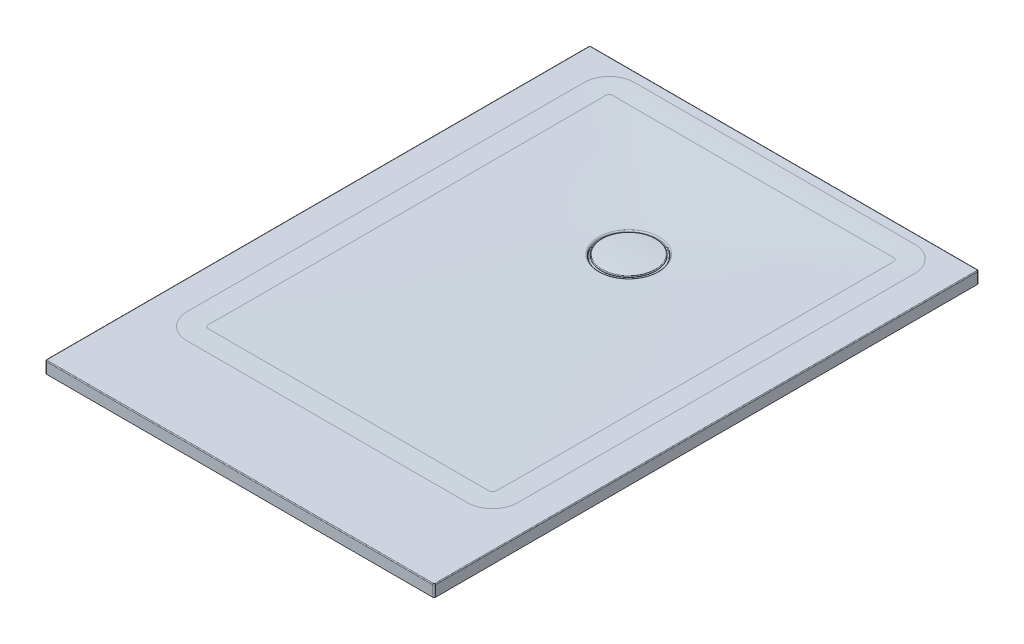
SolidWorks part; units mm, degrees
ref_plane "Płaszczyzna przednia" through (0, 0, 0) normal (0, 0, 1) x (1, 0, 0)
ref_plane "Płaszczyzna górna" through (0, 0, 0) normal (0, 1, 0) x (1, 0, 0)
ref_plane "Płaszczyzna prawa" through (0, 0, 0) normal (1, 0, 0) x (0, 0, -1)
sketch "Szkic2" plane through (0, 0, 0) normal (0, 1, 0) x (1, 0, 0)
  line L0 (0, 700) -> (0, 300) construction
  line L1 (-500, -700) -> (500, -700)
  line L2 (-500, -700) -> (-500, 700)
  line L3 (-500, 700) -> (500, 700)
  line L4 (500, -700) -> (500, 700)
  line L5 (-500, -700) -> (500, 700) construction
  line L6 (-500, 700) -> (500, -700) construction
  line L7 (-410, 660) -> (410, 660)
  line L8 (-410, 660) -> (-410, -460)
  line L9 (-410, -460) -> (410, -460)
  line L10 (410, 660) -> (410, -460)
  line L11 (-450, 700) -> (-450, -500) construction
  line L12 (-450, -500) -> (450, -500) construction
  line L13 (450, -500) -> (450, 700) construction
  circle A0 centre (0, 300) radius 75
  point P0 (0, 0)
  point P11 (0, 660)
  point P16 (0, -500)
  dimension "D9" = 150
  dimension "D1" = 1000
  dimension "D2" = 1400
  dimension "D3" = 40
  dimension "D4" = 90
  dimension "D5" = 40
  dimension "D6" = 50
  dimension "D7" = 1200
  dimension "D8" = 400
  dimension "D10" = 900
sketch "Szkic3" plane through (0, 0, 0) normal (0, 1, 0) x (1, 0, 0)
  line L0 (-500, -700) -> (-500, 700) construction
  line L1 (-500, -700) -> (500, -700) construction
  line L2 (500, -700) -> (500, 700) construction
  line L3 (-500, 700) -> (500, 700) construction
  line L4 (-410, 660) -> (-410, -460) construction
  line L5 (-410, 660) -> (410, 660) construction
  line L6 (410, 660) -> (410, -460) construction
  line L7 (-410, -460) -> (410, -460) construction
  line L8 (-500, -700) -> (-500, 700)
  line L9 (-500, -700) -> (500, -700)
  line L10 (500, -700) -> (500, 700)
  line L11 (-500, 700) -> (500, 700)
  line L12 (-410, 610) -> (-410, -410)
  line L13 (-360, 660) -> (360, 660)
  line L14 (410, 610) -> (410, -410)
  line L15 (-360, -460) -> (360, -460)
  arc A0 (410, 610) -> (360, 660) centre (360, 610) ccw
  arc A1 (-360, 660) -> (-410, 610) centre (-360, 610) ccw
  arc A2 (360, -460) -> (410, -410) centre (360, -410) ccw
  arc A3 (-360, -460) -> (-410, -410) centre (-360, -410) cw
  dimension "D1" = 50
surface "Powierzchnia-Płaszczyzna1" sketch "Szkic3"
sketch "Szkic4" plane through (0, 0, 0) normal (0, 1, 0) x (1, 0, 0)
  line L0 (-410, 660) -> (-410, -460) construction
  line L1 (-410, -460) -> (410, -460) construction
  line L2 (410, 660) -> (410, -460) construction
  line L3 (-410, 660) -> (410, 660) construction
  line L4 (-410, 660) -> (-410, -460)
  line L5 (-410, -460) -> (410, -460)
  line L6 (410, 660) -> (410, -460)
  line L7 (-410, 660) -> (410, 660)
ref_plane "korek" through (0, -15, 0) normal (0, 1, 0) x (-1, 0, 0)
sketch "Szkic5" plane through (0, -15, 0) normal (0, 1, 0) x (-1, 0, 0)
  circle A0 centre (0, -300) radius 75 construction
  circle A1 centre (0, -300) radius 75
surface "Powierzchnia-Wyciągnięcie po profilach2"
surface "Powierzchnia-Połącz1"
sketch "Szkic7" plane through (0, 0, 0) normal (0, 1, 0) x (1, 0, 0)
  line L27 (360, 620) -> (-360, 620)
  line L28 (-370, 610) -> (-370, -410)
  line L29 (-360, -420) -> (360, -420)
  line L30 (370, -410) -> (370, 610)
  line L31 (360, 620) -> (-360, 620)
  line L32 (-370, 610) -> (-370, -410)
  line L33 (-360, -420) -> (360, -420)
  line L34 (370, -410) -> (370, 610)
  line L35 (360, 675) -> (-360, 675)
  line L36 (-425, 610) -> (-425, -410)
  line L37 (-360, -475) -> (360, -475)
  line L38 (425, -410) -> (425, 610)
  line L39 (360, 675) -> (-360, 675)
  line L40 (-425, 610) -> (-425, -410)
  line L41 (-360, -475) -> (360, -475)
  line L42 (425, -410) -> (425, 610)
  arc A0 (370, -410) -> (360, -420) centre (360, -410) cw
  arc A1 (-370, -410) -> (-360, -420) centre (-360, -410) ccw
  arc A2 (370, 610) -> (360, 620) centre (360, 610) ccw
  arc A3 (-370, 610) -> (-360, 620) centre (-360, 610) cw
  spline S23 degree 3 poles (-591.5315, 335.3132) (181.3742, 504.6125) (377.0466, 575.5657) (369.7449, 612.2673) (369.6662, 612.584) (369.476, 613.2118) (369.3643, 613.5239) (368.9883, 614.4318) (368.6815, 615.006) (368.1377, 615.8209) (367.9418, 616.0856) (367.524, 616.5953) (367.3041, 616.8378) (366.6129, 617.5297) (366.1098, 617.9436) (365.2909, 618.492) (365.007, 618.6624) (364.4301, 618.9712) (364.1356, 619.1106) (363.5344, 619.3603) (363.2278, 619.4704) (362.6025, 619.6612) (362.282, 619.7412) (361.6363, 619.8714) (361.3114, 619.9185) (360.8216, 619.9669) (360.658, 619.9804) (348.1323, 620.6176) (332.3408, 590.3401) (433.8681, 1617.1995) knots -6.99685 -6.99685 -6.99685 -6.99685 0.125 0.125 0.1875 0.1875 0.25 0.25 0.375 0.375 0.4375 0.4375 0.5 0.5 0.625 0.625 0.6875 0.6875 0.75 0.75 0.8125 0.8125 0.875 0.875 0.9375 0.9375 0.96875 0.96875 3.322401 3.322401 3.322401 3.322401 only from (370, 610) to (360, 620)
  spline S24 degree 3 poles (-491.8511, 1611.2627) (-330.4534, 590.295) (-348.1092, 620.6178) (-360.657, 619.9805) (-360.8198, 619.967) (-361.3068, 619.919) (-361.629, 619.8725) (-362.2675, 619.7445) (-362.5843, 619.6661) (-363.2122, 619.4758) (-363.5243, 619.3642) (-364.4322, 618.9881) (-365.0063, 618.6813) (-366.0929, 617.9563) (-366.6075, 617.5344) (-367.5298, 616.6126) (-367.9438, 616.1096) (-368.4922, 615.2907) (-368.6624, 615.0068) (-368.9713, 614.43) (-369.1107, 614.1354) (-369.3603, 613.5343) (-369.4705, 613.2277) (-369.6612, 612.6023) (-369.7416, 612.282) (-379.3828, 564.1048) (-33.6844, 476.7199) (597.6089, 357.5576) knots -2.333455 -2.333455 -2.333455 -2.333455 0.03125 0.03125 0.0625 0.0625 0.125 0.125 0.1875 0.1875 0.25 0.25 0.375 0.375 0.5 0.5 0.625 0.625 0.6875 0.6875 0.75 0.75 0.8125 0.8125 0.875 0.875 10.137285 10.137285 10.137285 10.137285 only from (-360, 620) to (-370, 610)
  spline S25 degree 3 poles (591.5313, -135.3132) (-181.3742, -304.6125) (-377.0466, -375.5657) (-369.7449, -412.2673) (-369.6662, -412.584) (-369.476, -413.2118) (-369.3643, -413.5239) (-368.9883, -414.4318) (-368.6815, -415.006) (-368.1377, -415.8209) (-367.9418, -416.0856) (-367.524, -416.5953) (-367.3041, -416.8378) (-366.6129, -417.5297) (-366.1098, -417.9436) (-365.2909, -418.492) (-365.007, -418.6624) (-364.4301, -418.9712) (-364.1356, -419.1106) (-363.5344, -419.3603) (-363.2278, -419.4704) (-362.6025, -419.6612) (-362.282, -419.7412) (-361.6363, -419.8714) (-361.3114, -419.9185) (-360.8216, -419.9669) (-360.658, -419.9804) (-348.1323, -420.6176) (-332.3408, -390.3401) (-433.8681, -1417.1995) knots -6.99685 -6.99685 -6.99685 -6.99685 0.125 0.125 0.1875 0.1875 0.25 0.25 0.375 0.375 0.4375 0.4375 0.5 0.5 0.625 0.625 0.6875 0.6875 0.75 0.75 0.8125 0.8125 0.875 0.875 0.9375 0.9375 0.96875 0.96875 3.322401 3.322401 3.322401 3.322401 only from (-370, -410) to (-360, -420)
  spline S26 degree 3 poles (491.8511, -1411.2628) (330.4534, -390.2949) (348.1092, -420.6178) (360.657, -419.9805) (360.8198, -419.967) (361.3068, -419.919) (361.629, -419.8725) (362.2675, -419.7445) (362.5843, -419.6661) (363.2122, -419.4758) (363.5243, -419.3642) (364.4322, -418.9881) (365.0063, -418.6813) (366.0929, -417.9563) (366.6075, -417.5344) (367.5298, -416.6126) (367.9438, -416.1096) (368.4922, -415.2907) (368.6624, -415.0068) (368.9713, -414.43) (369.1107, -414.1354) (369.3603, -413.5343) (369.4705, -413.2277) (369.6612, -412.6023) (369.7416, -412.282) (379.3828, -364.1048) (33.6844, -276.7199) (-597.6089, -157.5576) knots -2.333455 -2.333455 -2.333455 -2.333455 0.03125 0.03125 0.0625 0.0625 0.125 0.125 0.1875 0.1875 0.25 0.25 0.375 0.375 0.5 0.5 0.625 0.625 0.6875 0.6875 0.75 0.75 0.8125 0.8125 0.875 0.875 10.137285 10.137285 10.137285 10.137285 only from (360, -420) to (370, -410)
  spline S31 degree 3 poles (-2396.7816, -366.7663) (-142.0852, 187.0381) (456.3465, 458.6139) (423.3422, 624.7385) (422.8287, 626.7968) (421.9018, 629.8577) (421.5659, 630.8751) (420.8441, 632.8937) (420.4599, 633.8901) (418.423, 638.8079) (416.4286, 642.5398) (413.4838, 646.9541) (412.8721, 647.8244) (411.6022, 649.5392) (410.9423, 650.3859) (408.9054, 652.8701) (407.4764, 654.4464) (402.9828, 658.9433) (399.7137, 661.634) (395.2775, 664.6044) (394.3701, 665.1801) (392.5355, 666.2813) (391.608, 666.8073) (388.7958, 668.3123) (386.8813, 669.2189) (382.9739, 670.8415) (380.981, 671.5574) (377.9323, 672.4867) (376.906, 672.7721) (374.8332, 673.2936) (373.7849, 673.5303) (370.636, 674.1603) (368.5249, 674.4732) (365.3411, 674.7883) (364.2771, 674.8687) (228.7392, 681.5942) (45.7001, 250.8763) (288.4189, 3654.4038) knots -4.814836 -4.814836 -4.814836 -4.814836 0.125 0.125 0.1875 0.1875 0.21875 0.21875 0.25 0.25 0.375 0.375 0.40625 0.40625 0.4375 0.4375 0.5 0.5 0.625 0.625 0.65625 0.65625 0.6875 0.6875 0.75 0.75 0.8125 0.8125 0.84375 0.84375 0.875 0.875 0.9375 0.9375 0.96875 0.96875 4.906915 4.906915 4.906915 4.906915 only from (425, 610) to (360, 675)
  spline S32 degree 3 poles (-444.4804, 3651.7965) (-0.0838, 210.6062) (-222.3945, 681.8988) (-364.2695, 674.8692) (-365.3288, 674.7892) (-368.4945, 674.4768) (-370.5876, 674.1675) (-374.7388, 673.3419) (-376.7972, 672.8285) (-379.8581, 671.9016) (-380.8755, 671.5658) (-382.8942, 670.8441) (-383.8905, 670.4598) (-388.8082, 668.4228) (-392.5401, 666.4284) (-396.9544, 663.4836) (-397.8246, 662.8719) (-399.5394, 661.6021) (-400.3861, 660.9422) (-402.8703, 658.9053) (-404.4466, 657.4762) (-408.9434, 652.9826) (-411.6341, 649.7135) (-414.6044, 645.2774) (-415.1802, 644.37) (-416.2813, 642.5353) (-416.8073, 641.6079) (-418.3124, 638.7958) (-419.2189, 636.8812) (-420.8414, 632.9738) (-421.5575, 630.9809) (-422.4867, 627.9322) (-422.7721, 626.9059) (-423.2937, 624.8332) (-423.5304, 623.7849) (-462.8275, 427.1539) (405.9488, 130.7727) (2419.409, -292.7026) knots -4.104544 -4.104544 -4.104544 -4.104544 0.03125 0.03125 0.0625 0.0625 0.125 0.125 0.1875 0.1875 0.21875 0.21875 0.25 0.25 0.375 0.375 0.40625 0.40625 0.4375 0.4375 0.5 0.5 0.625 0.625 0.65625 0.65625 0.6875 0.6875 0.75 0.75 0.8125 0.8125 0.84375 0.84375 0.875 0.875 6.697898 6.697898 6.697898 6.697898 only from (-360, 675) to (-425, 610)
  spline S33 degree 3 poles (2396.7817, 566.7663) (142.0852, 12.9619) (-456.3465, -258.6139) (-423.3422, -424.7385) (-422.8287, -426.7968) (-421.9018, -429.8577) (-421.5659, -430.8751) (-420.8441, -432.8937) (-420.4599, -433.8901) (-418.423, -438.8079) (-416.4286, -442.5398) (-413.4838, -446.9541) (-412.8721, -447.8244) (-411.6022, -449.5392) (-410.9423, -450.3859) (-408.9054, -452.8701) (-407.4764, -454.4464) (-402.9828, -458.9433) (-399.7137, -461.634) (-395.2775, -464.6044) (-394.3701, -465.1801) (-392.5355, -466.2813) (-391.608, -466.8073) (-388.7958, -468.3123) (-386.8813, -469.2189) (-382.9739, -470.8415) (-380.981, -471.5574) (-377.9323, -472.4867) (-376.906, -472.7721) (-374.8332, -473.2936) (-373.7849, -473.5303) (-370.636, -474.1603) (-368.5249, -474.4732) (-365.3411, -474.7883) (-364.2771, -474.8687) (-228.7392, -481.5942) (-45.7001, -50.8763) (-288.4189, -3454.4037) knots -4.814836 -4.814836 -4.814836 -4.814836 0.125 0.125 0.1875 0.1875 0.21875 0.21875 0.25 0.25 0.375 0.375 0.40625 0.40625 0.4375 0.4375 0.5 0.5 0.625 0.625 0.65625 0.65625 0.6875 0.6875 0.75 0.75 0.8125 0.8125 0.84375 0.84375 0.875 0.875 0.9375 0.9375 0.96875 0.96875 4.906915 4.906915 4.906915 4.906915 only from (-425, -410) to (-360, -475)
  spline S34 degree 3 poles (444.4805, -3451.7968) (0.0838, -10.6062) (222.3945, -481.8988) (364.2695, -474.8692) (365.3288, -474.7892) (368.4945, -474.4768) (370.5876, -474.1675) (374.7388, -473.3419) (376.7972, -472.8285) (379.8581, -471.9016) (380.8755, -471.5658) (382.8942, -470.8441) (383.8905, -470.4598) (388.8082, -468.4228) (392.5401, -466.4284) (396.9544, -463.4836) (397.8246, -462.8719) (399.5394, -461.6021) (400.3861, -460.9422) (402.8703, -458.9053) (404.4466, -457.4762) (408.9434, -452.9826) (411.6341, -449.7135) (414.6044, -445.2774) (415.1802, -444.37) (416.2813, -442.5353) (416.8073, -441.6079) (418.3124, -438.7958) (419.2189, -436.8812) (420.8414, -432.9738) (421.5575, -430.9809) (422.4867, -427.9322) (422.7721, -426.9059) (423.2937, -424.8332) (423.5304, -423.7849) (462.8275, -227.1539) (-405.9488, 69.2273) (-2419.409, 492.7026) knots -4.104544 -4.104544 -4.104544 -4.104544 0.03125 0.03125 0.0625 0.0625 0.125 0.125 0.1875 0.1875 0.21875 0.21875 0.25 0.25 0.375 0.375 0.40625 0.40625 0.4375 0.4375 0.5 0.5 0.625 0.625 0.65625 0.65625 0.6875 0.6875 0.75 0.75 0.8125 0.8125 0.84375 0.84375 0.875 0.875 6.697898 6.697898 6.697898 6.697898 only from (360, -475) to (425, -410)
  spline S35 degree 3 poles (425, 610) (425, 614.2917) (424.5793, 618.5117) (423.3422, 624.7385) (422.8287, 626.7968) (421.9018, 629.8577) (421.5659, 630.8751) (420.8441, 632.8937) (420.4599, 633.8901) (418.423, 638.8079) (416.4286, 642.5398) (413.4838, 646.9541) (412.8721, 647.8244) (411.6022, 649.5392) (410.9423, 650.3859) (408.9054, 652.8701) (407.4764, 654.4464) (402.9828, 658.9433) (399.7137, 661.634) (395.2775, 664.6044) (394.3701, 665.1801) (392.5355, 666.2813) (391.608, 666.8073) (388.7958, 668.3123) (386.8813, 669.2189) (382.9739, 670.8415) (380.981, 671.5574) (377.9323, 672.4867) (376.906, 672.7721) (374.8332, 673.2936) (373.7849, 673.5303) (370.636, 674.1603) (368.5249, 674.4732) (365.3411, 674.7883) (364.2771, 674.8687) (362.143, 674.9746) (361.0729, 675) (360, 675) knots 0 0 0 0 0.125 0.125 0.1875 0.1875 0.21875 0.21875 0.25 0.25 0.375 0.375 0.40625 0.40625 0.4375 0.4375 0.5 0.5 0.625 0.625 0.65625 0.65625 0.6875 0.6875 0.75 0.75 0.8125 0.8125 0.84375 0.84375 0.875 0.875 0.9375 0.9375 0.96875 0.96875 1 1 1 1
  spline S36 degree 3 poles (-360, 675) (-361.0729, 675) (-362.1416, 674.9746) (-364.2695, 674.8692) (-365.3288, 674.7892) (-368.4945, 674.4768) (-370.5876, 674.1675) (-374.7388, 673.3419) (-376.7972, 672.8285) (-379.8581, 671.9016) (-380.8755, 671.5658) (-382.8942, 670.8441) (-383.8905, 670.4598) (-388.8082, 668.4228) (-392.5401, 666.4284) (-396.9544, 663.4836) (-397.8246, 662.8719) (-399.5394, 661.6021) (-400.3861, 660.9422) (-402.8703, 658.9053) (-404.4466, 657.4762) (-408.9434, 652.9826) (-411.6341, 649.7135) (-414.6044, 645.2774) (-415.1802, 644.37) (-416.2813, 642.5353) (-416.8073, 641.6079) (-418.3124, 638.7958) (-419.2189, 636.8812) (-420.8414, 632.9738) (-421.5575, 630.9809) (-422.4867, 627.9322) (-422.7721, 626.9059) (-423.2937, 624.8332) (-423.5304, 623.7849) (-424.5793, 618.5367) (-425, 614.2917) (-425, 610) knots 0 0 0 0 0.03125 0.03125 0.0625 0.0625 0.125 0.125 0.1875 0.1875 0.21875 0.21875 0.25 0.25 0.375 0.375 0.40625 0.40625 0.4375 0.4375 0.5 0.5 0.625 0.625 0.65625 0.65625 0.6875 0.6875 0.75 0.75 0.8125 0.8125 0.84375 0.84375 0.875 0.875 1 1 1 1
  spline S37 degree 3 poles (-425, -410) (-425, -414.2917) (-424.5793, -418.5117) (-423.3422, -424.7385) (-422.8287, -426.7968) (-421.9018, -429.8577) (-421.5659, -430.8751) (-420.8441, -432.8937) (-420.4599, -433.8901) (-418.423, -438.8079) (-416.4286, -442.5398) (-413.4838, -446.9541) (-412.8721, -447.8244) (-411.6022, -449.5392) (-410.9423, -450.3859) (-408.9054, -452.8701) (-407.4764, -454.4464) (-402.9828, -458.9433) (-399.7137, -461.634) (-395.2775, -464.6044) (-394.3701, -465.1801) (-392.5355, -466.2813) (-391.608, -466.8073) (-388.7958, -468.3123) (-386.8813, -469.2189) (-382.9739, -470.8415) (-380.981, -471.5574) (-377.9323, -472.4867) (-376.906, -472.7721) (-374.8332, -473.2936) (-373.7849, -473.5303) (-370.636, -474.1603) (-368.5249, -474.4732) (-365.3411, -474.7883) (-364.2771, -474.8687) (-362.143, -474.9746) (-361.0729, -475) (-360, -475) knots 0 0 0 0 0.125 0.125 0.1875 0.1875 0.21875 0.21875 0.25 0.25 0.375 0.375 0.40625 0.40625 0.4375 0.4375 0.5 0.5 0.625 0.625 0.65625 0.65625 0.6875 0.6875 0.75 0.75 0.8125 0.8125 0.84375 0.84375 0.875 0.875 0.9375 0.9375 0.96875 0.96875 1 1 1 1
  spline S38 degree 3 poles (360, -475) (361.0729, -475) (362.1416, -474.9746) (364.2695, -474.8692) (365.3288, -474.7892) (368.4945, -474.4768) (370.5876, -474.1675) (374.7388, -473.3419) (376.7972, -472.8285) (379.8581, -471.9016) (380.8755, -471.5658) (382.8942, -470.8441) (383.8905, -470.4598) (388.8082, -468.4228) (392.5401, -466.4284) (396.9544, -463.4836) (397.8246, -462.8719) (399.5394, -461.6021) (400.3861, -460.9422) (402.8703, -458.9053) (404.4466, -457.4762) (408.9434, -452.9826) (411.6341, -449.7135) (414.6044, -445.2774) (415.1802, -444.37) (416.2813, -442.5353) (416.8073, -441.6079) (418.3124, -438.7958) (419.2189, -436.8812) (420.8414, -432.9738) (421.5575, -430.9809) (422.4867, -427.9322) (422.7721, -426.9059) (423.2937, -424.8332) (423.5304, -423.7849) (424.5793, -418.5367) (425, -414.2917) (425, -410) knots 0 0 0 0 0.03125 0.03125 0.0625 0.0625 0.125 0.125 0.1875 0.1875 0.21875 0.21875 0.25 0.25 0.375 0.375 0.40625 0.40625 0.4375 0.4375 0.5 0.5 0.625 0.625 0.65625 0.65625 0.6875 0.6875 0.75 0.75 0.8125 0.8125 0.84375 0.84375 0.875 0.875 1 1 1 1
  dimension "D3" = 10
  dimension "D1" = 40
  dimension "D2" = 15
other "Usuń ścianę1"
other "Granica-Powierzchnia1"
surface "Powierzchnia-Połącz2"
sketch "Szkic9" plane through (0, 0, 0) normal (0, 1, 0) x (1, 0, 0)
  line L0 (-500, -700) -> (500, -700) construction
  line L1 (-500, -700) -> (-500, 700) construction
  line L2 (500, -700) -> (500, 700) construction
  line L3 (-500, 700) -> (500, 700) construction
  line L4 (-500, -700) -> (500, -700)
  line L5 (-500, -700) -> (-500, 700)
  line L6 (500, -700) -> (500, 700)
  line L7 (-500, 700) -> (500, 700)
surface "Powierzchnia-Wyciągnięcie1" sketch "Szkic9" parameters "D1"=30
sketch "Szkic8" plane through (0, 0, 0) normal (1, 0, 0) x (0, 0, -1)
  line L0 (300, 0) -> (300, -30) construction
  line L1 (224.9999, -15) -> (225.2968, -23.5)
  line L4 (225.2968, -23.5) -> (248, -24.0945)
  line L5 (225.2968, -23.5) -> (300, -23.5) construction
  line L6 (248, -24.0945) -> (248, -30) construction
  line L7 (300, -30) -> (225.2968, -30) construction
  line L8 (225.2968, -30) -> (225.2968, -23.5) construction
  line L9 (255, -28) -> (255, -30)
  line L10 (248, -24.0945) -> (255, -28)
  dimension "D1" = 30
  dimension "D2" = 8.5
  dimension "D3" = 2
  dimension "D4" = 1.5
  dimension "D5" = 52
  dimension "D6" = 45
  dimension "D7" = 2
surface "Powierzchnia-Obrót1" sketch "Szkic8" parameters "D1"=360
surface "Powierzchnia-Płaszczyzna2"
surface "Powierzchnia-Połącz3"
fillet "Zaokrąglenie4" radius 4 4 edges at (-500, -15, -700) (500, -15, -700) (-500, -15, 700) (500, -15, 700)
fillet "Zaokrąglenie5" radius 3 3 edges at (0, -24.0945, -352) (0, -23.5, -374.7032)
fillet "Zaokrąglenie6" radius 2 9 edges at (498.8284, 0, 698.8284) (0, 0, 700) (-498.8284, 0, 698.8284) (-500, 0, 0) (-498.8284, 0, -698.8284) (0, 0, -700) (498.8284, 0, -698.8284) (500, 0, 0) (0, -28, -345)
sketch "Szkic11" plane through (0, 0, 0) normal (1, 0, 0) x (0, 0, -1)
  line L0 (300, 0) -> (300, -30) construction
  line L1 (-696, -30) -> (696, -30) construction
  line L2 (300, -17) -> (300, -11.5)
  line L14 (370, -11.5) -> (370, -14.5) construction
  line L16 (370, -17) -> (300, -17)
  line L18 (370, -17) -> (370, -16.3377)
  line L19 (300, -11.5) -> (370, -11.5) construction
  arc A0 (370, -16.3377) -> (368.1666, -14.3446) centre (368, -16.3377) ccw
  arc A6 (368.1666, -14.3446) -> (300, -11.5) centre (300, -829.6667) ccw
  dimension "D2" = 2
  dimension "D8" = 2.5
  dimension "D9" = 17
  dimension "D10" = 5.5
  dimension "D11" = 70
revolve "Obrót1" add sketch "Szkic11" angle 360 about L0
